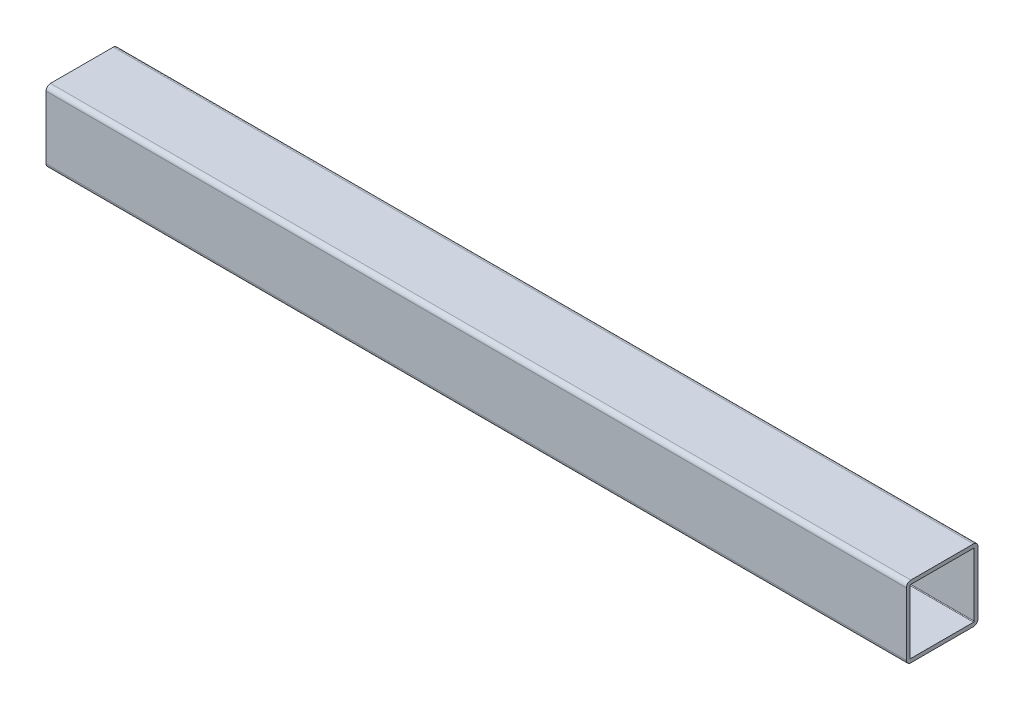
SolidWorks part; units mm, degrees
ref_plane "Front Plane" through (0, 0, 0) normal (0, 0, 1) x (1, 0, 0)
ref_plane "Top Plane" through (0, 0, 0) normal (0, 1, 0) x (1, 0, 0)
ref_plane "Right Plane" through (0, 0, 0) normal (1, 0, 0) x (0, 0, -1)
sketch "Sketch1" plane through (0, 0, 0) normal (1, 0, 0) x (0, 0, -1)
  line L0 (-5.373, 3.898) -> (16.852, 3.898)
  line L1 (-5.373, 5.2442) -> (16.852, 5.2442)
  line L2 (-6.9605, 3.6567) -> (-6.9605, -18.5683)
  line L3 (-5.373, -20.1558) -> (16.852, -20.1558)
  line L4 (18.4395, 3.6567) -> (18.4395, -18.5683)
  line L5 (17.0933, 3.6567) -> (17.0933, -18.5683)
  line L6 (-5.373, -18.8096) -> (16.852, -18.8096)
  line L7 (-5.6143, 3.6567) -> (-5.6143, -18.5683)
  arc A0 (16.852, 5.2442) -> (18.4395, 3.6567) centre (16.852, 3.6567) cw
  arc A1 (-6.9605, 3.6567) -> (-5.373, 5.2442) centre (-5.373, 3.6567) cw
  arc A2 (-5.373, -20.1558) -> (-6.9605, -18.5683) centre (-5.373, -18.5683) cw
  arc A3 (18.4395, -18.5683) -> (16.852, -20.1558) centre (16.852, -18.5683) cw
  arc A4 (16.852, 3.898) -> (17.0933, 3.6567) centre (16.852, 3.6567) cw
  arc A5 (17.0933, -18.5683) -> (16.852, -18.8096) centre (16.852, -18.5683) cw
  arc A6 (-5.373, -18.8096) -> (-5.6143, -18.5683) centre (-5.373, -18.5683) cw
  arc A7 (-5.6143, 3.6567) -> (-5.373, 3.898) centre (-5.373, 3.6567) cw
  point P6 (18.4395, 5.2442)
  point P9 (-6.9605, 5.2442)
  point P14 (18.4395, -20.1558)
  dimension "D3" = 1.5875
  dimension "D1" = 25.4
  dimension "D2" = 25.4
  dimension "D4" = 1.3462
extrude "Extrude1" add sketch "Sketch1" along normal blind 304.8
